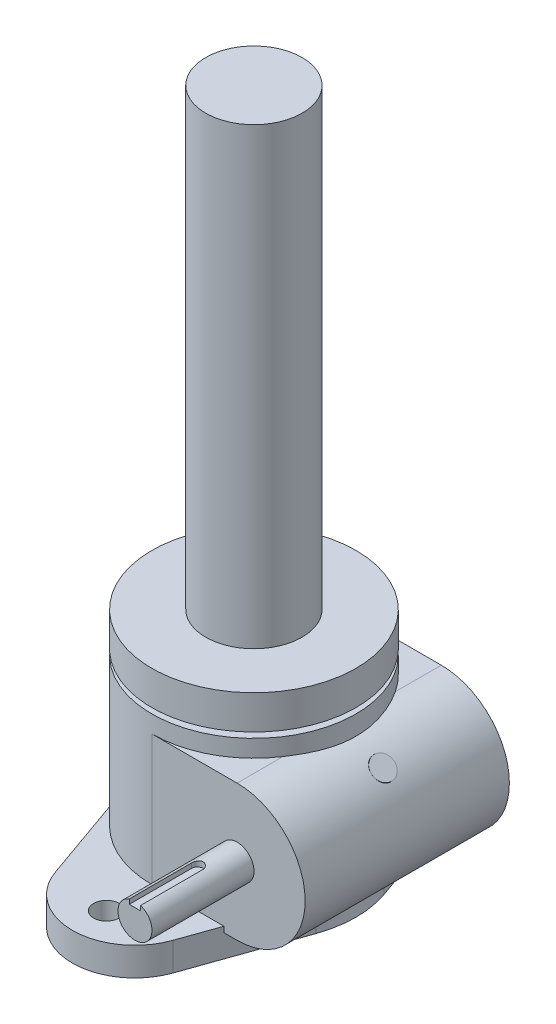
SolidWorks part; units mm, degrees
ref_plane "Front" through (0, 0, 0) normal (0, 0, 1) x (1, 0, 0)
ref_plane "Top" through (0, 0, 0) normal (0, 1, 0) x (1, 0, 0)
ref_plane "Right" through (0, 0, 0) normal (1, 0, 0) x (0, 0, -1)
ref_plane "Worm_Housing_1Limit" through (0, 0, -28.575) normal (0, 0, 1) x (1, 0, 0)
ref_plane "Worm_Housing_2Limit" through (0, 0, 28.575) normal (0, 0, 1) x (1, 0, 0)
sketch "Sketch1" plane through (0, 0, 0) normal (0, 0, 1) x (1, 0, 0)
  line L3 (0, -9.525) -> (-14.2875, -9.525) construction
  line L9 (-14.2875, -9.525) -> (-14.2875, 0) construction
  line L10 (0, 0) -> (-28.575, 0) construction
  line L11 (-28.575, 0) -> (-28.575, 49.276) construction
  line L13 (-22.987, 49.276) -> (-22.987, 50.8) construction
  line L14 (-28.575, 49.276) -> (-22.987, 49.276) construction
  line L15 (-22.987, 50.8) -> (-28.575, 50.8) construction
  line L16 (-28.575, 50.8) -> (-28.575, 60.325) construction
  line L17 (-28.575, 60.325) -> (0, 60.325) construction
  line L18 (0, 0) -> (0, 143.9633) construction
  line L19 (0, 0) -> (0, 143.9633) construction
  line L20 (-13.4938, 187.325) -> (-13.4937, 60.325) construction
  line L22 (-13.4938, 187.325) -> (0, 187.325) construction
  line L24 (0, -9.525) -> (-14.2875, -9.525)
  line L25 (-14.2875, -9.525) -> (-14.2875, 0)
  line L26 (-14.2875, 0) -> (-28.575, 0)
  line L27 (-28.575, 0) -> (-28.575, 49.276)
  line L28 (-22.987, 49.276) -> (-22.987, 50.8)
  line L29 (-28.575, 49.276) -> (-22.987, 49.276)
  line L30 (-22.987, 50.8) -> (-28.575, 50.8)
  line L31 (-28.575, 50.8) -> (-28.575, 60.325)
  line L32 (-28.575, 60.325) -> (-13.4937, 60.325)
  line L33 (-13.4938, 187.325) -> (-13.4937, 60.325)
  line L34 (-13.4938, 187.325) -> (0, 187.325)
  line L35 (0, 187.325) -> (0, -9.525)
revolve "Base-Revolve" add sketch "Sketch1" angle 360 about L19
sketch "Sketch2" plane through (0, 0, 0) normal (0, 0, 1) x (1, 0, 0)
  line L0 (0, 0) -> (0, 143.9633) construction
  line L1 (23.8633, 6.35) -> (0, 6.35) construction
  line L2 (23.8633, 44.45) -> (0, 44.45) construction
  line L4 (23.8633, 6.35) -> (0, 6.35)
  line L5 (23.8633, 44.45) -> (0, 44.45)
  line L6 (0, 44.45) -> (0, 6.35)
  arc A0 (23.8633, 6.35) -> (23.8633, 44.45) centre (23.8633, 25.4) ccw construction
  arc A1 (23.8633, 6.35) -> (23.8633, 44.45) centre (23.8633, 25.4) ccw
extrude "Boss-Extrude2" add sketch "Sketch2" along normal up to surface (28.575 mm away) and the other way up to surface (28.575 mm away)
ref_plane "Plane1" through (23.8633, 0, 0) normal (-1, 0, 0) x (0, 0, 1)
sketch "Sketch3" plane through (23.8633, 0, 0) normal (-1, 0, 0) x (0, 0, 1)
  line L0 (-105.8953, 25.4) -> (105.8953, 25.4) construction
  line L1 (-28.6004, 20.6502) -> (57.15, 20.6502)
  line L2 (-28.6004, 20.6502) -> (-28.6004, 25.4)
  line L3 (-28.6004, 25.4) -> (57.15, 25.4)
  line L4 (57.15, 20.6502) -> (57.15, 25.4)
revolve "Boss-Revolve1" add sketch "Sketch3" angle 360 about L0
ref_plane "Plane3" through (0, 28.5648, 0) normal (0, 1, 0) x (-1, 0, 0)
sketch "Sketch8" plane through (0, 28.5623, 0) normal (0, 1, 0) x (-1, 0, 0)
  line L3 (-25.4508, -28.6004) -> (-22.2758, -28.6004)
  line L4 (-25.4508, -11.1379) -> (-25.4508, -28.6004)
  line L5 (-22.2758, -28.6004) -> (-22.2758, -11.1379)
  line L6 (-25.4508, -28.6004) -> (-22.2758, -28.6004)
  line L7 (-25.4508, -11.1379) -> (-25.4508, -28.6004)
  line L8 (-22.2758, -28.6004) -> (-22.2758, -11.1379)
  arc A1 (-22.2758, -11.1379) -> (-25.4508, -11.1379) centre (-23.8633, -11.1379) ccw
  arc A2 (-22.2758, -11.1379) -> (-25.4508, -11.1379) centre (-23.8633, -11.1379) ccw
  dimension "D1" = 0
extrude "Cut-Keyway1" cut sketch "Sketch8" along normal up to surface (0.0025 mm away)
sketch "Sketch5" plane through (0, 0, 0) normal (0, 1, 0) x (-1, 0, 0)
  line L4 (26.9408, 9.525) -> (16.4638, 39.1583)
  line L5 (16.4638, -39.1583) -> (26.9408, -9.525)
  line L6 (-26.9408, -9.525) -> (-16.4638, -39.1583)
  line L7 (-16.4638, 39.1583) -> (-26.9408, 9.525)
  line L8 (26.9408, 9.525) -> (16.4638, 39.1583)
  line L9 (16.4638, -39.1583) -> (26.9408, -9.525)
  line L10 (-26.9408, -9.525) -> (-16.4638, -39.1583)
  line L11 (-16.4638, 39.1583) -> (-26.9408, 9.525)
  circle A0 centre (0, -41.275) radius 3.5719 construction
  circle A1 centre (0, -41.275) radius 3.5719
  circle A2 centre (0, 41.275) radius 3.5719 construction
  circle A3 centre (0, 41.275) radius 3.5719
  arc A4 (26.9408, -9.525) -> (26.9408, 9.525) centre (0, 0) ccw
  arc A5 (-16.4638, -39.1583) -> (16.4638, -39.1583) centre (0, -33.3375) ccw
  arc A6 (-26.9408, 9.525) -> (-26.9408, -9.525) centre (0, 0) ccw
  arc A7 (16.4638, 39.1583) -> (-16.4638, 39.1583) centre (0, 33.3375) ccw
  arc A8 (26.9408, -9.525) -> (26.9408, 9.525) centre (0, 0) ccw
  arc A9 (-16.4638, -39.1583) -> (16.4638, -39.1583) centre (0, -33.3375) ccw
  arc A10 (-26.9408, 9.525) -> (-26.9408, -9.525) centre (0, 0) ccw
  arc A11 (16.4638, 39.1583) -> (-16.4638, 39.1583) centre (0, 33.3375) ccw
  dimension "D1" = 0
ref_plane "Plane2" through (0, 7.9375, 0) normal (0, 1, 0) x (-1, 0, 0)
extrude "Boss-Extrude3" add sketch "Sketch5" along normal up to surface (7.9375 mm away)
sketch "Sketch6" plane through (0, 0, 0) normal (0, 0, 1) x (1, 0, 0)
  line L2 (0, -28.575) -> (-7.9375, -28.575) construction
  line L3 (0, 187.325) -> (0, -28.575) construction
  line L4 (0, 184.785) -> (0, -28.575)
  line L6 (-7.9375, -28.575) -> (-7.9375, 172.085) construction
  line L8 (0, 0) -> (0, 143.9633) construction
  line L9 (0, 9.525) -> (-10.9537, 9.525) construction
  line L10 (-10.9537, 60.325) -> (-10.9537, 9.525) construction
  line L11 (-10.9538, 184.785) -> (-10.9537, 60.325) construction
  line L12 (-10.9538, 184.785) -> (0, 184.785) construction
  line L15 (0, -28.575) -> (-7.9375, -28.575)
  line L16 (0, 0) -> (0, 143.9633) construction
  line L17 (-7.9375, -28.575) -> (-7.9375, 9.525)
  line L18 (-7.9375, 9.525) -> (-10.9537, 9.525)
  line L19 (-10.9537, 60.325) -> (-10.9537, 9.525)
  line L20 (-10.9538, 184.785) -> (-10.9537, 60.325)
  line L21 (-10.9538, 184.785) -> (0, 184.785)
revolve "Cut-Revolve1" cut sketch "Sketch6" angle 360 about L16
sketch "Sketch7" plane through (0, 0, 0) normal (0, 0, 1) x (1, 0, 0)
  line L0 (23.8633, 25.4) -> (49.6328, 56.1109) construction
  line L1 (23.8633, 25.4) -> (49.6328, 56.1109) construction
  line L2 (38.5406, 37.9523) -> (36.1084, 39.9931) construction
  line L3 (34.0676, 37.561) -> (36.4997, 35.5201) construction
  line L4 (36.4997, 35.5201) -> (38.5406, 37.9523) construction
  line L5 (36.1084, 39.9931) -> (34.0676, 37.561) construction
  line L6 (34.0676, 37.561) -> (36.4997, 35.5201)
  line L7 (36.4997, 35.5201) -> (38.5406, 37.9523)
  line L8 (38.5406, 37.9523) -> (36.1084, 39.9931)
  line L9 (36.1084, 39.9931) -> (34.0676, 37.561)
revolve "Boss-Revolve2" add sketch "Sketch7" angle 360 about L1
ref_plane "Plane4" through (0, 53.9623, 0) normal (0, 1, 0) x (-1, 0, 0)
sketch "Sketch10" plane through (0, 28.5623, 0) normal (0, 1, 0) x (-1, 0, 0)
  line L3 (-22.2758, 57.15) -> (-25.4508, 57.15)
  line L4 (-25.4508, 57.15) -> (-25.4508, 39.6875)
  line L5 (-22.2758, 39.6875) -> (-22.2758, 57.15)
  line L6 (-22.2758, 57.15) -> (-25.4508, 57.15)
  line L7 (-25.4508, 57.15) -> (-25.4508, 39.6875)
  line L8 (-22.2758, 39.6875) -> (-22.2758, 57.15)
  arc A1 (-25.4508, 39.6875) -> (-22.2758, 39.6875) centre (-23.8633, 39.6875) ccw
  arc A2 (-25.4508, 39.6875) -> (-22.2758, 39.6875) centre (-23.8633, 39.6875) ccw
  dimension "D1" = 0
extrude "Cut-Keyway2" cut sketch "Sketch10" along normal up to surface (25.4 mm away)
